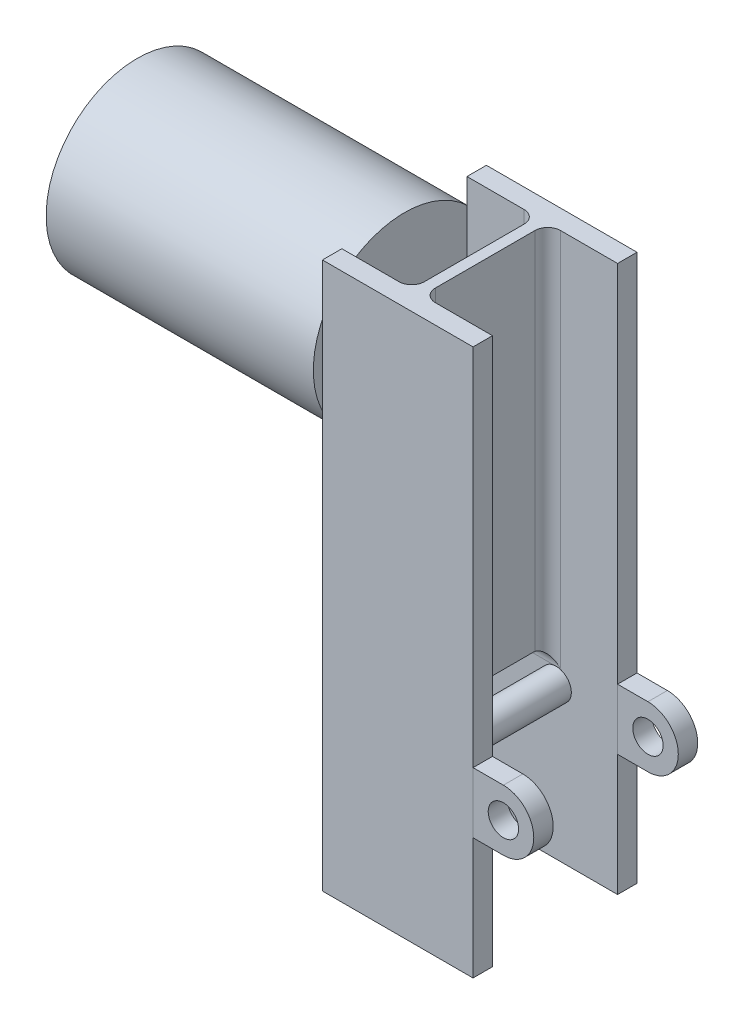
SolidWorks part; units mm, degrees
ref_plane "Ebene vorne" through (0, 0, 0) normal (0, 0, 1) x (1, 0, 0)
ref_plane "Ebene oben" through (0, 0, 0) normal (0, 1, 0) x (1, 0, 0)
ref_plane "Ebene rechts" through (0, 0, 0) normal (1, 0, 0) x (0, 0, -1)
sketch "Skizze1" plane through (0, 0, 0) normal (0, 0, 1) x (1, 0, 0)
  line L0 (0, 0) -> (0, 900)
  dimension "D1" = 900
other "Strukturbauteil1"
ref_plane "Ebene1" through (0, 0, 0) normal (0, 1, 0) x (-1, 0, 0)
sketch "Skizze11" plane through (0, 0, 0) normal (0, 1, 0) x (-1, 0, 0)
  line L0 (-124, -135) -> (-124, -103)
  line L1 (-124, -103) -> (-30, -103)
  line L2 (-9, -82) -> (-9, 82)
  line L3 (-30, 103) -> (-124, 103)
  line L4 (-124, 103) -> (-124, 135)
  line L5 (-124, 135) -> (124, 135)
  line L6 (124, 135) -> (124, 103)
  line L7 (124, 103) -> (30, 103)
  line L8 (9, 82) -> (9, -82)
  line L9 (30, -103) -> (124, -103)
  line L10 (124, -103) -> (124, -135)
  line L11 (124, -135) -> (-124, -135)
  line L14 (0, -135) -> (0, 135) construction
  arc A0 (-30, -103) -> (-9, -82) centre (-30, -82) ccw
  arc A1 (-9, 82) -> (-30, 103) centre (-30, 82) ccw
  arc A2 (30, 103) -> (9, 82) centre (30, 82) ccw
  arc A3 (9, -82) -> (30, -103) centre (30, -82) ccw
  point P22 (124, 0)
  point P23 (-124, 0)
  point P25 (0, 0)
  dimension "D5" = 32
  dimension "D4" = 21
  dimension "D1" = 248
  dimension "D2" = 270
  dimension "D3" = 18
sketch "Skizze12" plane through (0, 0, 135) normal (0, 0, 1) x (1, 0, 0)
  line L0 (124, 900) -> (124, 0) construction
  line L1 (-124, 0) -> (124, 0) construction
  line L2 (124, 200) -> (174, 200)
  line L3 (124, 300) -> (124, 200)
  line L4 (174, 300) -> (124, 300)
  line L5 (174, 250) -> (256.0452, 250) construction
  circle A0 centre (174, 250) radius 25
  arc A1 (174, 200) -> (174, 300) centre (174, 250) ccw
  dimension "D1" = 50
  dimension "D3" = 50
  dimension "D4" = 100
  dimension "D5" = 200
extrude "Linear austragen1" add sketch "Skizze12" against normal up to surface (32 mm away) separate body
mirror "Spiegeln1" about plane through (0, 0, 0) normal (0, 0, 1)
sketch "Skizze13" plane through (0, 0, -103) normal (0, 0, 1) x (1, 0, 0)
  line L2 (174, 250) -> (22.8568, 250) construction
  circle A0 centre (22.8568, 250) radius 25
  dimension "D1" = 50
extrude "Linear austragen2" add sketch "Skizze13" along normal up to surface (206 mm away) separate body
sketch "Skizze14" plane through (0, 0, 0) normal (0, 0, 1) x (1, 0, 0)
  line L0 (-124, 0) -> (124, 0) construction
  line L1 (-124, 600) -> (-564, 600)
  line L2 (-124, 600) -> (-124, 750)
  line L3 (-124, 750) -> (-564, 750) construction
  line L4 (-564, 600) -> (-564, 750)
  line L5 (-124, 900) -> (-124, 0) construction
  line L6 (-564, 750) -> (-124, 750)
  dimension "D1" = 300
  dimension "D2" = 750
  dimension "D3" = 440
revolve "Rotation1" add sketch "Skizze14" angle 360 about L3
sketch "Skizze15" plane through (9, 0, 0) normal (1, 0, 0) x (0, 0, -1)
  line L0 (-82, 0) -> (82, 0) construction
  line L1 (-103, 0) -> (103, 0)
  line L2 (-103, 0) -> (-103, 275)
  line L3 (-78, 300) -> (78, 300)
  line L4 (103, 0) -> (103, 275)
  line L5 (0, 0) -> (0, 342.3331) construction
  line L6 (0, 0) -> (0, 900) construction
  line L7 (-103, 900) -> (-103, 0) construction
  arc A0 (-103, 275) -> (-78, 300) centre (-78, 275) cw
  arc A1 (78, 300) -> (103, 275) centre (78, 275) cw
  point P13 (-103, 300)
  point P16 (103, 300)
  dimension "D2" = 25
  dimension "D3" = 300
extrude "Schnitt-Linear austragen1" cut sketch "Skizze15" against normal through all and the other way through all
